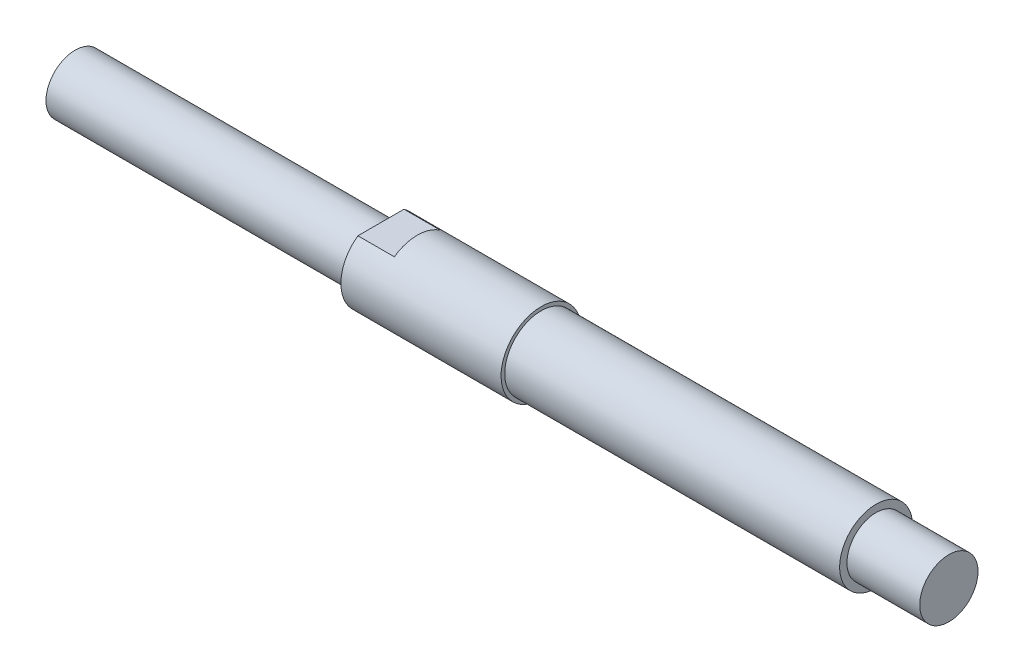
SolidWorks part; units mm, degrees
ref_plane "Plan de face" through (0, 0, 0) normal (0, 0, 1) x (1, 0, 0)
ref_plane "Plan de dessus" through (0, 0, 0) normal (0, 1, 0) x (1, 0, 0)
ref_plane "Plan de droite" through (0, 0, 0) normal (1, 0, 0) x (0, 0, -1)
sketch "Esquisse1" plane through (0, 0, 0) normal (0, 0, 1) x (1, 0, 0)
  line L0 (-2.9129, 0) -> (66.8544, 0) construction
  line L1 (0, 0) -> (60, 0)
  line L2 (0, 0) -> (0, 2.75)
  line L3 (0, 2.75) -> (60, 2.75)
  line L4 (60, 0) -> (60, 2.75)
  dimension "D1" = 60
  dimension "D2" = 2.75
revolve "Révolution1" add sketch "Esquisse1" angle 360 about L0
sketch "Esquisse2" plane through (60, 0, 0) normal (1, 0, 0) x (0, 0, -1)
  circle A0 centre (0, 0) radius 2
  circle A1 centre (0, 0) radius 2.75 construction
  circle A2 centre (0, 0) radius 2.75
  dimension "D1" = 4
extrude "Enlèv. mat.-Extru.1" cut sketch "Esquisse2" against normal blind 5
sketch "Esquisse3" plane through (55, 0, 0) normal (1, 0, 0) x (0, 0, -1)
  circle A1 centre (0, 0) radius 2.75 construction
  circle A2 centre (0, 0) radius 2.5
  circle A3 centre (0, 0) radius 2.75
  dimension "D1" = 5
extrude "Enlèv. mat.-Extru.2" cut sketch "Esquisse3" against normal blind 23
sketch "Esquisse4" plane through (0, 0, 0) normal (-1, 0, 0) x (0, 0, 1)
  circle A0 centre (0, 0) radius 2
  circle A1 centre (0, 0) radius 2.75 construction
  circle A2 centre (0, 0) radius 2.75
  dimension "D1" = 4
extrude "Enlèv. mat.-Extru.3" cut sketch "Esquisse4" against normal blind 21
ref_plane "Plan1" through (0, -2.75, 0) normal (0, 1, 0) x (1, 0, 0)
sketch "Esquisse5" plane through (0, -2.75, 0) normal (0, 1, 0) x (1, 0, 0)
  line L1 (21, -2.75) -> (23.5, -2.75)
  line L2 (21, -2.75) -> (21, 2.6496)
  line L3 (21, 2.6496) -> (23.5, 2.6496)
  line L4 (23.5, -2.75) -> (23.5, 2.6496)
  dimension "D1" = 2.5
extrude "Enlèv. mat.-Extru.5" cut sketch "Esquisse5" along normal blind 0.5
sketch "Esquisse6" plane through (0, -2.75, 0) normal (0, 1, 0) x (1, 0, 0)
  line L0 (32, -2.5) -> (55, -2.5) construction
  line L1 (36.5, -2.5) -> (40, -2.5)
  line L2 (36.5, -2.5) -> (36.5, 2.5)
  line L3 (36.5, 2.5) -> (40, 2.5)
  line L4 (40, -2.5) -> (40, 2.5)
  line L5 (55, 2.5) -> (32, 2.5) construction
  line L6 (55, -2.5) -> (55, 2.5) construction
  dimension "D1" = 15
  dimension "D2" = 3.5
extrude "Enlèv. mat.-Extru.7" cut sketch "Esquisse6" along normal blind 0.5
sketch "Esquisse7" plane through (0, 0, 0) normal (0, 0, 1) x (1, 0, 0)
  line L0 (-2.7937, 0) -> (65.1705, 0) construction
pattern_circular "Répétition circulaire1" count 2 every 180 about axis through (23.5, 0, 0) along (0, 0, 1) of "Enlèv. mat.-Extru.5"
